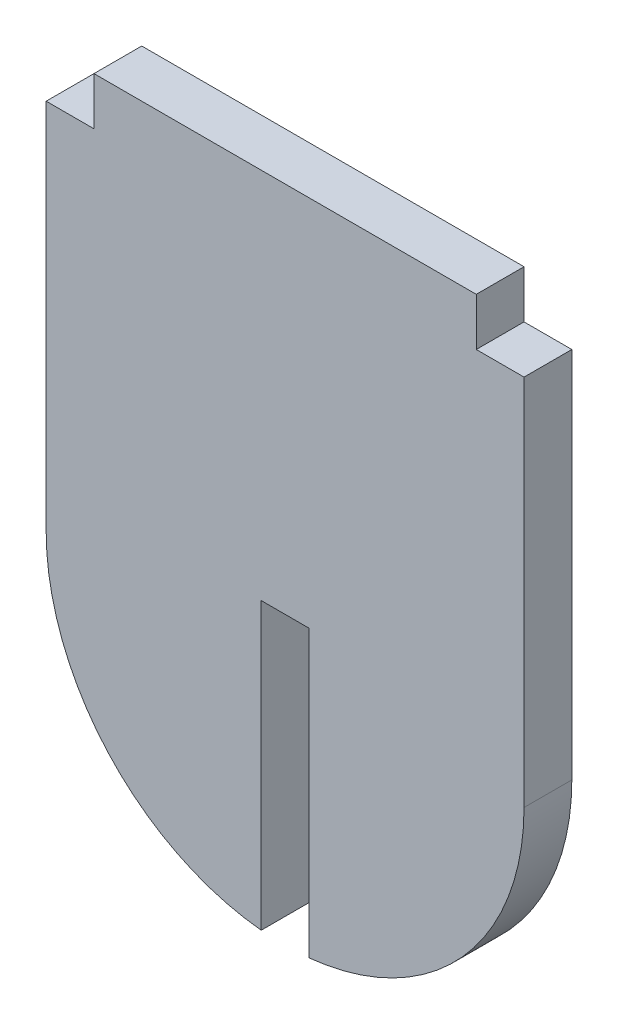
SolidWorks part; units mm, degrees
ref_plane "Front Plane" through (0, 0, 0) normal (0, 0, 1) x (1, 0, 0)
ref_plane "Top Plane" through (0, 0, 0) normal (0, 1, 0) x (1, 0, 0)
ref_plane "Right Plane" through (0, 0, 0) normal (1, 0, 0) x (0, 0, -1)
sketch "Sketch1" plane through (0, 0, 0) normal (0, 0, 1) x (1, 0, 0)
  line L1 (-15.875, 13.97) -> (15.875, 13.97)
  line L2 (-15.875, 13.97) -> (-15.875, -13.97)
  line L4 (15.875, 13.97) -> (15.875, -13.97)
  line L5 (-15.875, 13.97) -> (15.875, -13.97) construction
  line L6 (-15.875, -13.97) -> (15.875, 13.97) construction
  arc A0 (-15.875, -13.97) -> (15.875, -13.97) centre (0, -13.97) ccw
  point P0 (0, 0)
  dimension "D1" = 31.75
  dimension "D2" = 27.94
extrude "Boss-Extrude1" add sketch "Sketch1" along normal blind 3.175
sketch "Sketch2" plane through (0, 0, 3.175) normal (0, 0, 1) x (1, 0, 0)
  line L1 (-15.875, 13.97) -> (-12.7, 13.97)
  line L2 (-15.875, 13.97) -> (-15.875, 10.795)
  line L3 (-15.875, 10.795) -> (-12.7, 10.795)
  line L4 (-12.7, 13.97) -> (-12.7, 10.795)
  line L5 (15.875, 13.97) -> (12.7, 13.97)
  line L6 (15.875, 13.97) -> (15.875, 10.795)
  line L7 (15.875, 10.795) -> (12.7, 10.795)
  line L8 (12.7, 13.97) -> (12.7, 10.795)
  dimension "D1" = 3.175
  dimension "D2" = 3.175
  dimension "D3" = 3.175
  dimension "D4" = 3.175
extrude "Cut-Extrude1" cut sketch "Sketch2" against normal through all
sketch "Sketch3" plane through (0, 0, 3.175) normal (0, 0, 1) x (1, 0, 0)
  line L1 (-1.5875, -10.795) -> (1.5875, -10.795)
  line L2 (-1.5875, -10.795) -> (-1.5875, -29.845)
  line L3 (-1.5875, -29.845) -> (1.5875, -29.845)
  line L4 (1.5875, -10.795) -> (1.5875, -29.845)
  line L5 (-1.5875, -10.795) -> (1.5875, -29.845) construction
  line L6 (-1.5875, -29.845) -> (1.5875, -10.795) construction
  arc A1 (-15.875, -13.97) -> (15.875, -13.97) centre (0, -13.97) ccw construction
  point P0 (0, -20.32)
  dimension "D1" = 19.05
  dimension "D2" = 3.175
extrude "Cut-Extrude2" cut sketch "Sketch3" against normal through all
